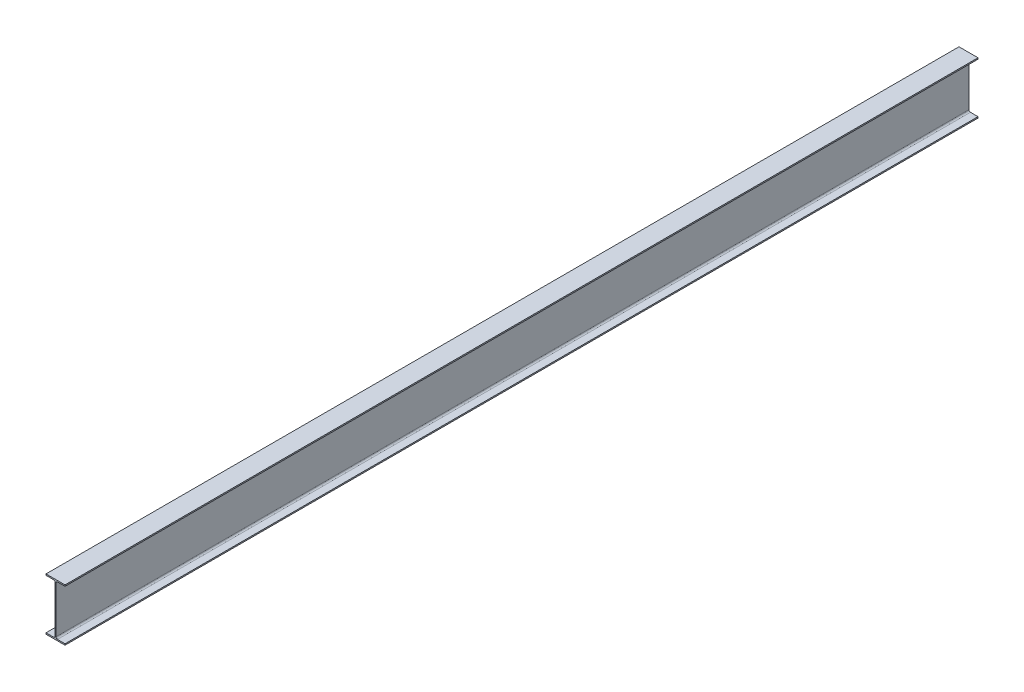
SolidWorks part; units mm, degrees
ref_plane "Front Plane" through (0, 0, 0) normal (0, 0, 1) x (1, 0, 0)
ref_plane "Top Plane" through (0, 0, 0) normal (0, 1, 0) x (1, 0, 0)
ref_plane "Right Plane" through (0, 0, 0) normal (1, 0, 0) x (0, 0, -1)
sketch "Sketch1" plane through (0, 0, 0) normal (0, 0, 1) x (1, 0, 0)
  point P0 (0, 0)
  line B0 (-63.5, -174.498) -> (-63.5, -165.989)
  line B1 (-63.5, -165.989) -> (-13.081, -165.989)
  line B2 (-2.921, -155.829) -> (-2.921, 155.829)
  line B3 (-13.081, 165.989) -> (-63.5, 165.989)
  line B4 (-63.5, 165.989) -> (-63.5, 174.498)
  line B5 (-63.5, 174.498) -> (63.5, 174.498)
  line B6 (63.5, 174.498) -> (63.5, 165.989)
  line B7 (63.5, 165.989) -> (13.081, 165.989)
  line B8 (2.921, 155.829) -> (2.921, -155.829)
  line B9 (13.081, -165.989) -> (63.5, -165.989)
  line B10 (63.5, -165.989) -> (63.5, -174.498)
  line B11 (63.5, -174.498) -> (-63.5, -174.498)
  line B12 (0, -174.498) -> (0, 174.498) construction
  arc B13 (-13.081, -165.989) -> (-2.921, -155.829) centre (-13.081, -155.829) ccw
  arc B14 (-2.921, 155.829) -> (-13.081, 165.989) centre (-13.081, 155.829) ccw
  arc B15 (13.081, 165.989) -> (2.921, 155.829) centre (13.081, 155.829) ccw
  arc B16 (2.921, -155.829) -> (13.081, -165.989) centre (13.081, -155.829) ccw
sketch_block_instance "w14x22-1"
sketch_block "w14x22"
extrude "Boss-Extrude1" add sketch "Sketch1" along normal mid plane 6096
